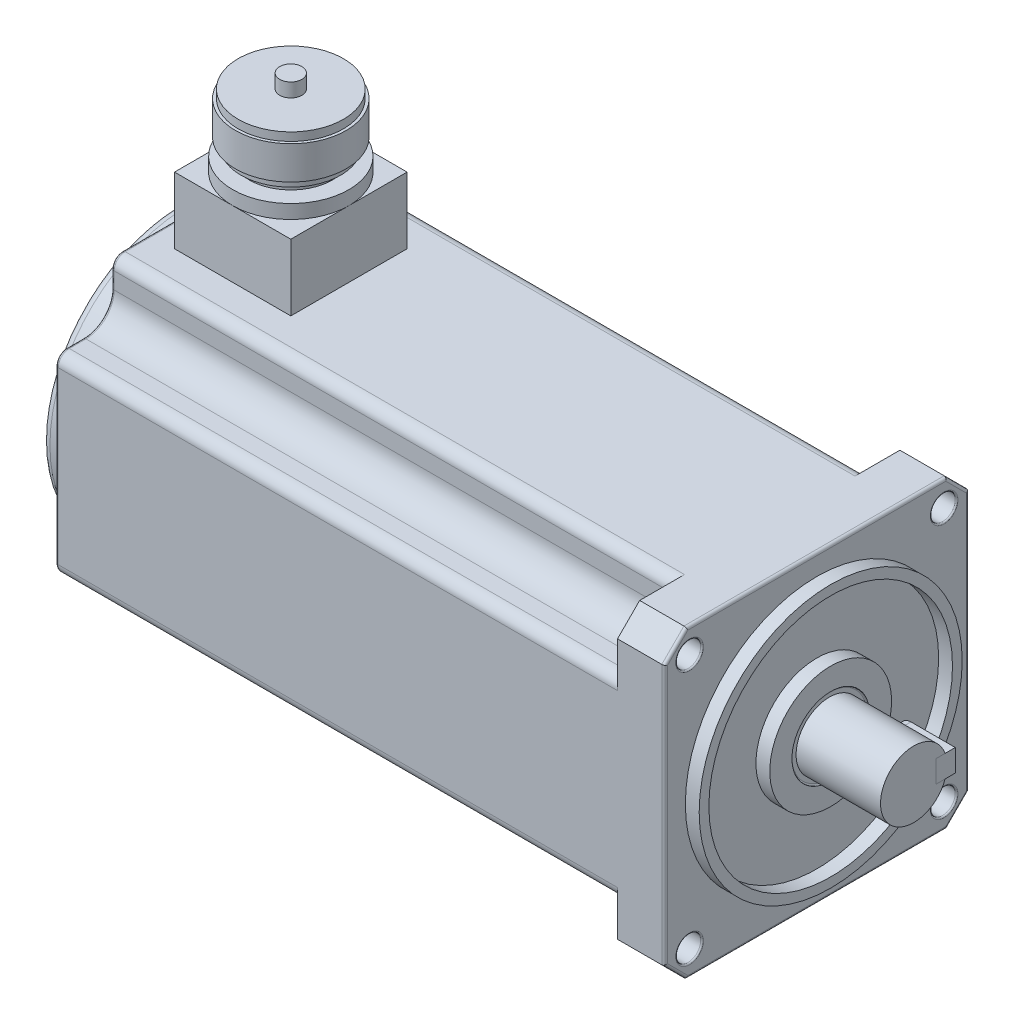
SolidWorks part; units mm, degrees
ref_plane "前视基准面" through (0, 0, 0) normal (0, 0, 1) x (1, 0, 0)
ref_plane "上视基准面" through (0, 0, 0) normal (0, 1, 0) x (1, 0, 0)
ref_plane "右视基准面" through (0, 0, 0) normal (1, 0, 0) x (0, 0, -1)
sketch "草图1" plane through (0, 0, 0) normal (1, 0, 0) x (0, 0, -1)
  line L0 (-55, 47) -> (-47, 55)
  line L1 (-47, -55) -> (47, -55)
  line L2 (-55, -47) -> (-55, 47)
  line L3 (-47, 55) -> (47, 55)
  line L4 (55, -47) -> (55, 47)
  line L5 (-55, -55) -> (55, 55) construction
  line L6 (-55, 55) -> (55, -55) construction
  line L7 (47, 55) -> (55, 47)
  line L8 (47, -55) -> (55, -47)
  line L9 (-55, -47) -> (-47, -55)
  point P0 (0, 0)
extrude "凸台-拉伸1" add sketch "草图1" against normal blind 220
sketch "草图2" plane through (-220, 0, 0) normal (-1, 0, 0) x (0, 0, 1)
  line L0 (-45, 34.802) -> (-51, 34.802)
  line L1 (-55, -47) -> (-55, 47) construction
  line L2 (-30.802, 55) -> (-47, 55)
  line L3 (-51, -34.802) -> (-45, -34.802)
  line L4 (-47, 55) -> (-55, 47)
  line L5 (-34.802, -45) -> (-34.802, -51)
  line L6 (47, -55) -> (-47, -55) construction
  line L7 (-55, 47) -> (-55, 30.802)
  line L8 (34.802, -51) -> (34.802, -45)
  line L9 (-55, -30.802) -> (-55, -47)
  line L10 (45, -34.802) -> (51, -34.802)
  line L11 (55, 47) -> (55, -47) construction
  line L12 (-55, -47) -> (-47, -55)
  line L13 (51, 34.802) -> (45, 34.802)
  line L14 (-47, -55) -> (-30.802, -55)
  line L15 (34.802, 45) -> (34.802, 51)
  line L16 (-47, 55) -> (47, 55) construction
  line L17 (30.802, -55) -> (47, -55)
  line L18 (-34.802, 51) -> (-34.802, 45)
  line L19 (47, -55) -> (55, -47)
  line L20 (55, -47) -> (55, -30.802)
  line L21 (55, 30.802) -> (55, 47)
  line L22 (55, 47) -> (47, 55)
  line L23 (47, 55) -> (30.802, 55)
  arc A0 (-45, 34.802) -> (-34.802, 45) centre (-45, 45) ccw
  arc A1 (34.802, 45) -> (45, 34.802) centre (45, 45) ccw
  arc A2 (45, -34.802) -> (34.802, -45) centre (45, -45) ccw
  arc A3 (-34.802, -45) -> (-45, -34.802) centre (-45, -45) ccw
  arc A4 (-55, -30.802) -> (-51, -34.802) centre (-51, -30.802) ccw
  arc A5 (-34.802, -51) -> (-30.802, -55) centre (-30.802, -51) ccw
  arc A6 (30.802, -55) -> (34.802, -51) centre (30.802, -51) ccw
  arc A7 (55, -30.802) -> (51, -34.802) centre (51, -30.802) cw
  arc A8 (55, 30.802) -> (51, 34.802) centre (51, 30.802) ccw
  arc A9 (34.802, 51) -> (30.802, 55) centre (30.802, 51) ccw
  arc A10 (-30.802, 55) -> (-34.802, 51) centre (-30.802, 51) ccw
  arc A11 (-55, 30.802) -> (-51, 34.802) centre (-51, 30.802) cw
  point P10 (-55, -34.802)
  point P38 (-34.802, -55)
  point P41 (34.802, -55)
  point P44 (55, -34.802)
  point P47 (55, 34.802)
  point P50 (34.802, 55)
  point P53 (-34.802, 55)
  point P56 (-55, 34.802)
  dimension "D1" = 4
extrude "切除-拉伸1" cut sketch "草图2" against normal blind 203
sketch "草图3" plane through (0, 0, 0) normal (1, 0, 0) x (0, 0, -1)
  circle A1 centre (-45.9619, 45.9619) radius 4.5
  circle A2 centre (45.9619, 45.9619) radius 4.5
  circle A3 centre (45.9619, -45.9619) radius 4.5
  circle A4 centre (-45.9619, -45.9619) radius 4.5
extrude "切除-拉伸2" cut sketch "草图3" against normal blind 17
fillet "圆角1" radius 1 24 edges at (-220, 37.7889, 37.7889) (-220, 34.802, 48) (-220, 33.6304, 53.8284) (-220, 0, 55) (-220, -33.6304, 53.8284) (-220, -34.802, 48) (-220, -37.7889, 37.7889) (-220, -48, 34.802) (-220, -53.8284, 33.6304) (-220, -55, 0) (-220, -53.8284, -33.6304) (-220, -48, -34.802) (-220, -37.7889, -37.7889) (-220, -34.802, -48) (-220, -33.6304, -53.8284) (-220, 0, -55) (-220, 33.6304, -53.8284) (-220, 34.802, -48) (-220, 37.7889, -37.7889) (-220, 48, -34.802) (-220, 53.8284, -33.6304) (-220, 55, 0) (-220, 53.8284, 33.6304) (-220, 48, 34.802)
fillet "圆角2" radius 1 8 edges at (0, 51, -51) (0, -51, -51) (0, 0, -55) (0, -55, 0) (0, -51, 51) (0, 0, 55) (0, 51, 51) (0, 55, 0)
fillet "圆角3" radius 0.5 4 edges at (0, -45.9619, 41.4619) (0, -45.9619, -50.4619) (0, 45.9619, -50.4619) (0, 45.9619, 41.4619)
sketch "草图4" plane through (-220, 0, 0) normal (-1, 0, 0) x (0, 0, 1)
  circle A0 centre (0, 0) radius 50
extrude "凸台-拉伸2" add sketch "草图4" along normal blind 10
fillet "圆角4" radius 3 1 edges at (-230, 0, 50)
sketch "草图5" plane through (0, 0, 0) normal (1, 0, 0) x (0, 0, -1)
  circle A0 centre (0, 0) radius 47.5
  circle A1 centre (0, 0) radius 44
extrude "凸台-拉伸3" add sketch "草图5" along normal blind 5
sketch "草图6" plane through (0, 0, 0) normal (1, 0, 0) x (0, 0, -1)
  circle A0 centre (0, 0) radius 22
extrude "凸台-拉伸4" add sketch "草图6" along normal blind 5
sketch "草图7" plane through (5, 0, 0) normal (1, 0, 0) x (0, 0, -1)
  circle A0 centre (0, 0) radius 14
extrude "切除-拉伸3" cut sketch "草图7" against normal blind 0.5
fillet "圆角5" radius 0.5 1 edges at (4.5, 0, -14)
sketch "草图8" plane through (4.5, 0, 0) normal (1, 0, 0) x (0, 0, -1)
  circle A0 centre (0, 0) radius 12
extrude "凸台-拉伸5" add sketch "草图8" along normal blind 30.5
ref_plane "基准面1" through (0, 0, -12) normal (0, 0, 1) x (1, 0, 0)
sketch "草图9" plane through (0, 0, -12) normal (0, 0, 1) x (1, 0, 0)
  line L1 (35, -12) -> (35, 12) construction
  line L2 (19, 4) -> (35, 4)
  line L3 (35, 4) -> (35, -4)
  line L4 (35, -4) -> (19, -4)
  arc A0 (19, 4) -> (19, -4) centre (19, 0) ccw
extrude "切除-拉伸5" cut sketch "草图9" along normal blind 4
sketch "草图10" plane through (0, 0, -8) normal (0, 0, -1) x (-1, 0, 0)
  line L0 (-19, 4) -> (-35, 4)
  line L1 (-35, 4) -> (-35, -4)
  line L2 (-35, -4) -> (-19, -4)
  arc A0 (-19, -4) -> (-19, 4) centre (-19, 0) ccw
extrude "凸台-拉伸6" add sketch "草图10" along normal blind 7 separate body
sketch "草图11" plane through (0, 55, 0) normal (0, 1, 0) x (1, 0, 0)
  line L3 (-211, -21) -> (-169, -21)
  line L4 (-211, -21) -> (-211, 21)
  line L5 (-211, 21) -> (-169, 21)
  line L6 (-169, -21) -> (-169, 21)
  line L7 (-211, -21) -> (-169, 21) construction
  line L8 (-211, 21) -> (-169, -21) construction
extrude "凸台-拉伸7" add sketch "草图11" along normal blind 24
sketch "草图12" plane through (0, 79, 0) normal (0, 1, 0) x (1, 0, 0)
  circle A0 centre (-190, 0) radius 21
extrude "凸台-拉伸8" add sketch "草图12" along normal blind 5
sketch "草图13" plane through (0, 84, 0) normal (0, 1, 0) x (1, 0, 0)
  circle A0 centre (-190, 0) radius 15
extrude "凸台-拉伸9" add sketch "草图13" along normal blind 3
sketch "草图14" plane through (0, 87, 0) normal (0, 1, 0) x (1, 0, 0)
  circle A0 centre (-190, 0) radius 18
extrude "凸台-拉伸10" add sketch "草图14" along normal blind 3
sketch "草图15" plane through (0, 90, 0) normal (0, 1, 0) x (1, 0, 0)
  circle A0 centre (-190, 0) radius 20
extrude "凸台-拉伸11" add sketch "草图15" along normal blind 12
sketch "草图16" plane through (0, 102, 0) normal (0, 1, 0) x (1, 0, 0)
  circle A0 centre (-190, 0) radius 19
extrude "凸台-拉伸12" add sketch "草图16" along normal blind 3
sketch "草图17" plane through (0, 105, 0) normal (0, 1, 0) x (1, 0, 0)
  circle A0 centre (-190, 0) radius 4
extrude "凸台-拉伸13" add sketch "草图17" along normal blind 5
